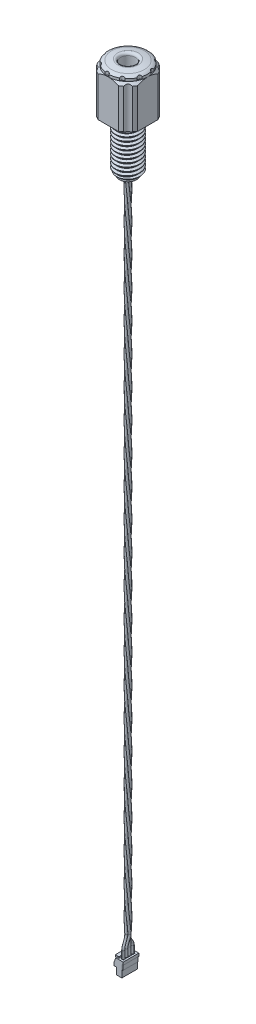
SolidWorks part; units mm, degrees
ref_plane "Front Plane" through (0, 0, 0) normal (0, 0, 1) x (1, 0, 0)
ref_plane "Top Plane" through (0, 0, 0) normal (0, 1, 0) x (1, 0, 0)
ref_plane "Right Plane" through (0, 0, 0) normal (1, 0, 0) x (0, 0, -1)
imported_body "BAR100-CAB-BLACK-300MM-R2-1-surface1"
imported_body "BAR100-CAB-GREEN-300MM-R2-1-surface1"
imported_body "BAR30-CAB-RED-300MM-R2-1-surface1"
imported_body "BAR100-CAB-WHITE-300MM-R2-1-surface1"
imported_body "MISC-ELEC-JST-GH-HOUSING-4POS-1-surface1"
imported_body "BAR-XT-M10-BULKHEAD-2-surface1"
imported_body "BAR-XT-M10-BULKHEAD-2-surface2"
imported_body "BAR-XT-PLUG-1-surface1"
imported_body "BAR-XT-PLUG-1-surface2"
imported_body "BAR-XT-M10-STRAIN-RELIEF-1-surface1"
imported_body "BAR-XT-M10-STRAIN-RELIEF-1-surface2"
surface "Surface-Plane1"
